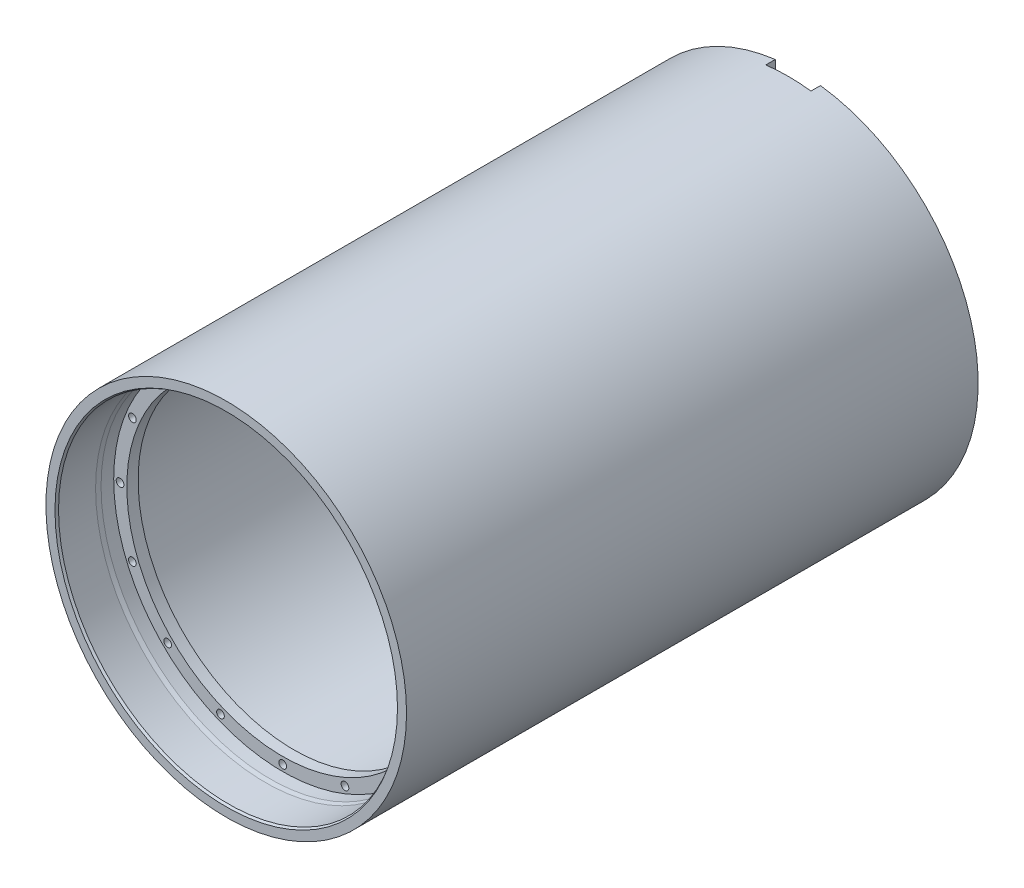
SolidWorks part; units mm, degrees
ref_plane "Front Plane" through (0, 0, 0) normal (0, 0, 1) x (1, 0, 0)
ref_plane "Top Plane" through (0, 0, 0) normal (0, 1, 0) x (1, 0, 0)
ref_plane "Right Plane" through (0, 0, 0) normal (1, 0, 0) x (0, 0, -1)
sketch "Sketch1" plane through (0, 0, 0) normal (0, 0, 1) x (1, 0, 0)
  circle A0 centre (0, 0) radius 101.346
  circle A1 centre (0, 0) radius 94.996
  dimension "D1" = 202.692
  dimension "D2" = 189.992
extrude "Extrude1" add sketch "Sketch1" along normal blind 321.31
ref_plane "fwd_rib_plane" through (0, 0, 38.1) normal (0, 0, 1) x (1, 0, 0)
ref_plane "aft_rib_plane" through (0, 0, 289.56) normal (0, 0, 1) x (1, 0, 0)
sketch "Sketch2" plane through (0, 0, 38.1) normal (0, 0, 1) x (1, 0, 0)
  circle A0 centre (0, 0) radius 101.346
  circle A1 centre (0, 0) radius 87.63
  dimension "D1" = 175.26
extrude "fwd_rib" add sketch "Sketch2" along normal blind 6.35
sketch "Sketch3" plane through (0, 0, 0) normal (0, 0, -1) x (-1, 0, 0)
  circle A0 centre (0, 0) radius 95.5294
  dimension "D1" = 191.0588
extrude "fwd_bore_seal" cut sketch "Sketch3" against normal blind 25.908
sketch "Sketch4" plane through (0, 0, 0) normal (0, 0, -1) x (-1, 0, 0)
  circle A0 centre (0, 0) radius 96.0374
  dimension "D1" = 192.0748
extrude "fwd_ortman_bore" cut sketch "Sketch4" against normal blind 6.35
ref_plane "ortman_plane" through (0, 0, 2.032) normal (0, 0, -1) x (-1, 0, 0)
sketch "Sketch5" plane through (0, 0, 2.032) normal (0, 0, -1) x (-1, 0, 0)
  circle A0 centre (0, 0) radius 97.6884
  dimension "D1" = 195.3768
extrude "ortman_groove" cut sketch "Sketch5" against normal blind 3.302
fillet "ortman_fillet" radius 1.651 2 edges at (-97.6884, 0, 2.032) (-97.6884, 0, 5.334)
chamfer "ortman_chamfer" distance 0.508 angle 60 1 edges at (-95.5294, 0, 6.35)
chamfer "fwd_bore_chamfer" distance 0.5334 distance2 2.54 1 edges at (-94.996, 0, 25.908)
sketch "Sketch6" plane through (0, 0, 289.56) normal (0, 0, 1) x (1, 0, 0)
  circle A0 centre (0, 0) radius 87.63
  circle A1 centre (0, 0) radius 101.346
  dimension "D1" = 175.26
extrude "aft_rib" add sketch "Sketch6" against normal blind 6.35
sketch "Sketch7" plane through (0, 0, 321.31) normal (0, 0, 1) x (1, 0, 0)
  circle A0 centre (0, 0) radius 95.5294
  dimension "D1" = 191.0588
extrude "aft_bore_seal" cut sketch "Sketch7" against normal blind 22.098
chamfer "aft_bore_chamfer" distance 0.5334 distance2 2.54 1 edges at (94.996, 0, 299.212)
sketch "Sketch8" plane through (0, 0, 38.1) normal (0, 0, -1) x (-1, 0, 0)
  circle A0 centre (0, 0) radius 91.44 construction
  circle A1 centre (0, 91.44) radius 2.159
  circle A2 centre (64.6578, 64.6578) radius 2.159
  circle A3 centre (91.44, 0) radius 2.159
  circle A4 centre (64.6578, -64.6578) radius 2.159
  circle A5 centre (0, -91.44) radius 2.159
  circle A6 centre (-64.6578, -64.6578) radius 2.159
  circle A7 centre (-91.44, 0) radius 2.159
  circle A8 centre (-64.6578, 64.6578) radius 2.159
  dimension "D1" = 4.318
  dimension "D2" = 182.88
extrude "fwd_bolt_circle" cut sketch "Sketch8" against normal blind 22.098
sketch "Sketch9" plane through (0, 0, 289.56) normal (0, 0, 1) x (1, 0, 0)
  circle A0 centre (0, 0) radius 91.44 construction
  circle A1 centre (0, 91.44) radius 2.159
  circle A2 centre (34.9926, 84.4795) radius 2.159
  circle A3 centre (64.6578, 64.6578) radius 2.159
  circle A4 centre (84.4795, 34.9926) radius 2.159
  circle A5 centre (91.44, 0) radius 2.159
  circle A6 centre (84.4795, -34.9926) radius 2.159
  circle A7 centre (64.6578, -64.6578) radius 2.159
  circle A8 centre (34.9926, -84.4795) radius 2.159
  circle A9 centre (0, -91.44) radius 2.159
  circle A10 centre (-34.9926, -84.4795) radius 2.159
  circle A11 centre (-64.6578, -64.6578) radius 2.159
  circle A12 centre (-84.4795, -34.9926) radius 2.159
  circle A13 centre (-91.44, 0) radius 2.159
  circle A14 centre (-84.4795, 34.9926) radius 2.159
  circle A15 centre (-64.6578, 64.6578) radius 2.159
  circle A16 centre (-34.9926, 84.4795) radius 2.159
  dimension "D1" = 182.88
  dimension "D2" = 4.318
extrude "aft_bolt_circle" cut sketch "Sketch9" against normal blind 22.098
sketch "Sketch10" plane through (0, 0, 0) normal (0, 1, 0) x (1, 0, 0)
  line L0 (0, 0) -> (0, -15.5114) construction
  line L1 (-12.7, 0) -> (12.7, 0)
  line L2 (96.0374, 0) -> (-96.0374, 0) construction
  line L3 (12.7, 0) -> (12.7, -5.334)
  line L4 (12.7, -5.334) -> (-12.7, -5.334)
  line L5 (-12.7, 0) -> (-12.7, -5.334)
  point P9 (0, -5.334)
  dimension "D1" = 12.7
  dimension "D2" = 5.334
extrude "fwd_ortman_notch" cut sketch "Sketch10" against normal through all and the other way through all
chamfer "Chamfer1" distance 1.27 angle 30 1 edges at (95.5294, 0, 321.31)
